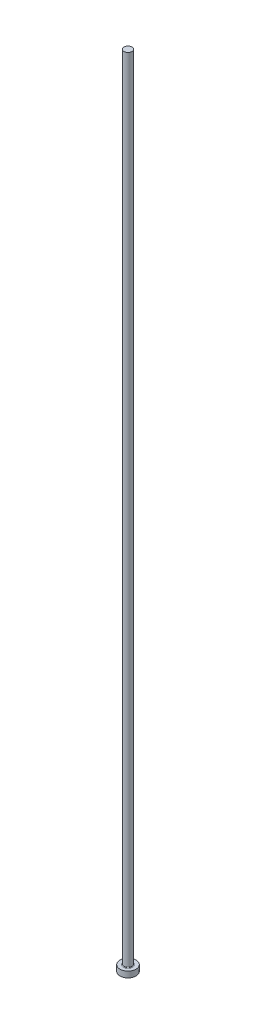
SolidWorks part; units mm, degrees
ref_plane "Plano frontal" through (0, 0, 0) normal (0, 0, 1) x (1, 0, 0)
ref_plane "Plano superior" through (0, 0, 0) normal (0, 1, 0) x (1, 0, 0)
ref_plane "Plano direito" through (0, 0, 0) normal (1, 0, 0) x (0, 0, -1)
sketch "Esboço1" plane through (0, 0, 0) normal (0, 0, 1) x (1, 0, 0)
  line L0 (0, 0) -> (4, 0)
  line L1 (4, 0) -> (4, 3)
  line L2 (4, 3) -> (2.3, 3)
  line L3 (2, 3.3) -> (2, 400)
  line L4 (2, 400) -> (0, 400)
  line L5 (0, 400) -> (0, 0) construction
  line L6 (0, 0) -> (0, 400)
  arc A0 (2.3, 3) -> (2, 3.3) centre (2.3, 3.3) cw
  dimension "D3" = 0.3
  dimension "D1" = 8
  dimension "D2" = 4
  dimension "D4" = 3
  dimension "D5" = 400
revolve "Revolução1" add sketch "Esboço1" angle 360 about L5
sketch "Esboço2"
  dimension "D1" = 0.45
  dimension "D2" = 0.7
  dimension "D3" = 0.3
  dimension "D4" = 2.15
wrap "Envolver1" sketch "Esboço2" wrap type deboss source sketch "Esboço2" thickness 0.1 parameters "D1"=0.1
